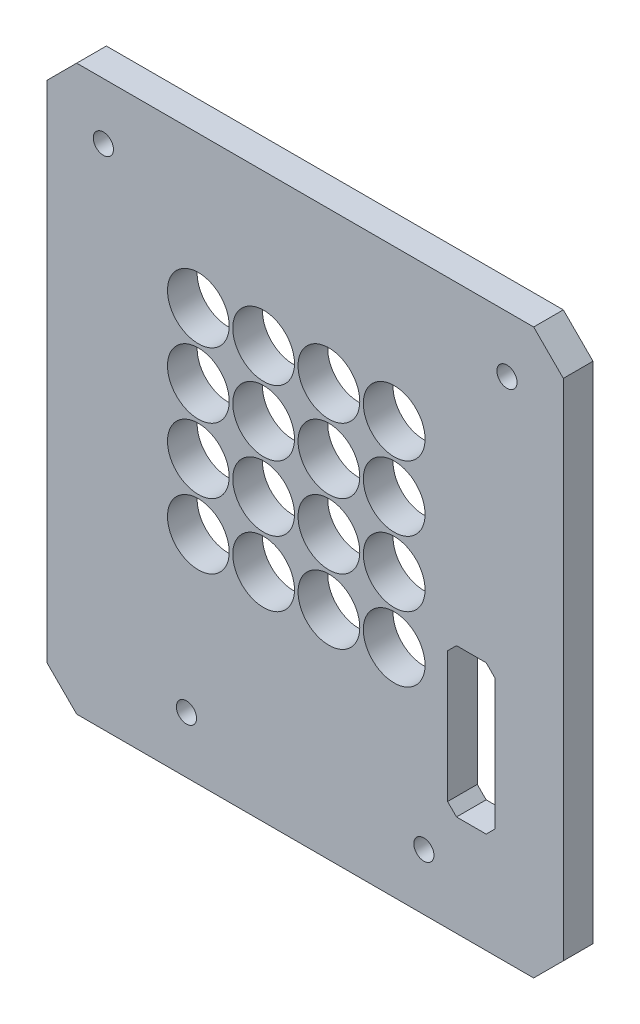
SolidWorks part; units mm, degrees
ref_plane "前视基准面" through (0, 0, 0) normal (0, 0, 1) x (1, 0, 0)
ref_plane "上视基准面" through (0, 0, 0) normal (0, 1, 0) x (1, 0, 0)
ref_plane "右视基准面" through (0, 0, 0) normal (1, 0, 0) x (0, 0, -1)
other "Configuration Table"
sketch "草图1" plane through (0, 0, 0) normal (0, 0, 1) x (1, 0, 0)
  line L0 (-37, -53) -> (40, -53)
  line L1 (40, -53) -> (45, -48)
  line L2 (45, -48) -> (45, 37)
  line L3 (45, 37) -> (40, 42)
  line L4 (40, 42) -> (-37, 42)
  line L5 (-37, 42) -> (-42, 37)
  line L6 (-42, 37) -> (-42, -48)
  line L7 (-42, -48) -> (-37, -53)
  line L8 (27, -36) -> (32, -36)
  line L9 (32, -36) -> (33.5, -34.5)
  line L10 (33.5, -34.5) -> (33.5, -12.5)
  line L11 (33.5, -12.5) -> (32, -11)
  line L12 (32, -11) -> (27, -11)
  line L13 (27, -11) -> (25.5, -12.5)
  line L14 (25.5, -12.5) -> (25.5, -34.5)
  line L15 (25.5, -34.5) -> (27, -36)
  circle A0 centre (-16.5, -16.5) radius 5.2
  circle A1 centre (-5.5, -16.5) radius 5.2
  circle A2 centre (5.5, -16.5) radius 5.2
  circle A3 centre (16.5, -16.5) radius 5.2
  circle A4 centre (-16.5, -5.5) radius 5.2
  circle A5 centre (-5.5, -5.5) radius 5.2
  circle A6 centre (5.5, -5.5) radius 5.2
  circle A7 centre (16.5, -5.5) radius 5.2
  circle A8 centre (-16.5, 5.5) radius 5.2
  circle A9 centre (-5.5, 5.5) radius 5.2
  circle A10 centre (5.5, 5.5) radius 5.2
  circle A11 centre (16.5, 5.5) radius 5.2
  circle A12 centre (-16.5, 16.5) radius 5.2
  circle A13 centre (-5.5, 16.5) radius 5.2
  circle A14 centre (5.5, 16.5) radius 5.2
  circle A15 centre (16.5, 16.5) radius 5.2
  circle A16 centre (-32.5, 32.5) radius 1.7
  circle A17 centre (35.5, 32.5) radius 1.7
  circle A18 centre (-18.5, -43.5) radius 1.7
  circle A19 centre (21.5, -43.5) radius 1.7
  dimension "D1" = 3.4
  dimension "D2" = 10.4
  dimension "D3" = 5.5
  dimension "D4" = 16.5
  dimension "D5" = 21.5
  dimension "D6" = 25.5
  dimension "D7" = 27
  dimension "D8" = 32
  dimension "D9" = 35.5
  dimension "D10" = 40
  dimension "D11" = 45
  dimension "D12" = 5.5
  dimension "D13" = 16.5
  dimension "D14" = 37
  dimension "D15" = 18.5
  dimension "D16" = 32.5
  dimension "D17" = 5.5
  dimension "D18" = 16.5
  dimension "D19" = 32.5
  dimension "D20" = 37
  dimension "D21" = 42
  dimension "D22" = 5.5
  dimension "D23" = 11
  dimension "D24" = 12.5
  dimension "D25" = 16.5
  dimension "D26" = 34.5
  dimension "D27" = 43.5
  dimension "D28" = 48
extrude "Guide_16_THROUGH_bores_and_R2_R16_window" add sketch "草图1" along normal blind 5
